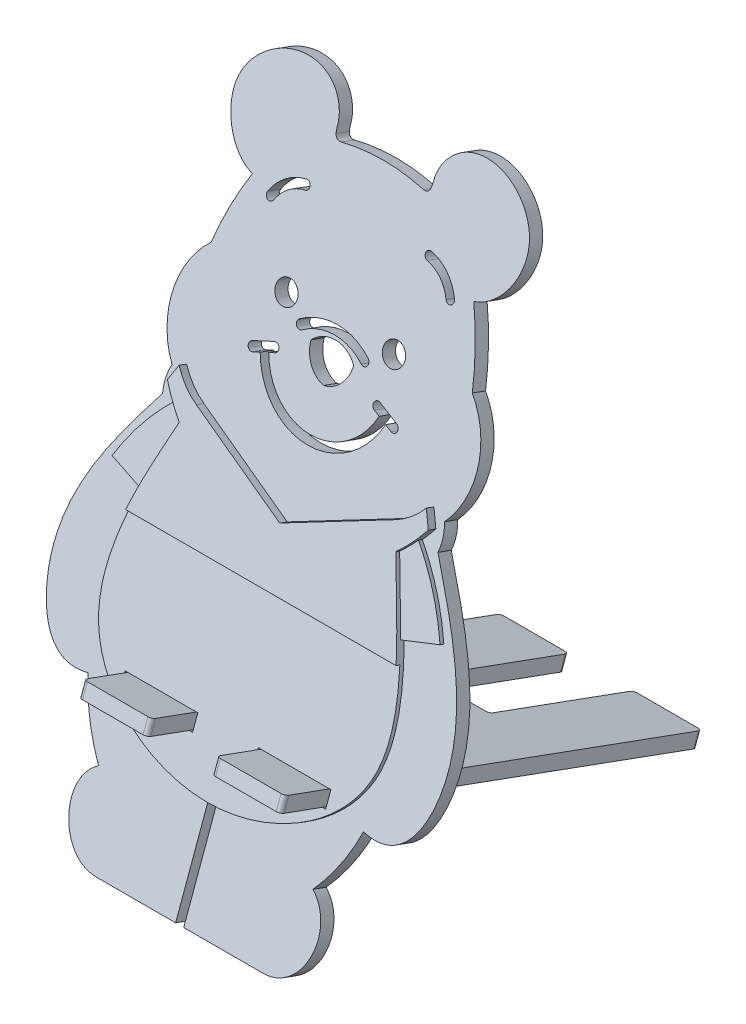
SolidWorks part; units mm, degrees
ref_plane "正面" through (0, 0, 0) normal (0, 0, 1) x (1, 0, 0)
ref_plane "平面" through (0, 0, 0) normal (0, 1, 0) x (1, 0, 0)
ref_plane "右側面" through (0, 0, 0) normal (1, 0, 0) x (0, 0, -1)
sketch "ｽｹｯﾁ1" plane through (0, 0, 0) normal (1, 0, 0) x (0, 0, -1)
  line L0 (0, 0) -> (54.7232, 150.3508)
  line L1 (-3.3662, 37.6222) -> (100, 0)
  line L2 (0, 0) -> (100, 0) construction
  dimension "D1" = 70
  dimension "D2" = 150.3508
  dimension "D3" = 100
  dimension "D4" = 3.3662
  dimension "D5" = 16.0307
  dimension "D6" = 110
  dimension "D7" = 160
ref_plane "キャラクター平面" through (0, 0, 0) normal (0, -0.342, -0.9397) x (0, 0.9397, -0.342)
ref_plane "H部品平面" through (0, 32.1394, -11.6978) normal (0, -0.9397, 0.342) x (0, -0.342, -0.9397)
sketch "ｽｹｯﾁ2" plane through (0, 0, 0) normal (1, 0, 0) x (0, 0, -1)
  line L0 (89.8069, 410.7384) -> (499.1403, 410.7384) construction
sketch "ｽｹｯﾁ3" plane through (0, 0, 0) normal (0, -0.342, -0.9397) x (0, 0.9397, -0.342)
  line L0 (-41.21, 73.4766) -> (72.1423, 80.9757) construction
sketch "ｽｹｯﾁ4" plane through (0, 32.1394, -11.6978) normal (0, -0.9397, 0.342) x (0, -0.342, -0.9397)
  line L0 (-38.6476, 0) -> (93.9693, 0) construction
  line L1 (-16.0307, -25) -> (93.9693, -25)
  line L2 (-16.0307, -25) -> (-16.0307, -8)
  line L3 (-16.0307, 25) -> (93.9693, 25)
  line L4 (93.9693, -25) -> (93.9693, -8)
  line L5 (-16.0307, 8) -> (-16.0307, 25)
  line L6 (0, -8) -> (-16.0307, -8)
  line L7 (0, -8) -> (0, 8)
  line L8 (0, 8) -> (-16.0307, 8)
  line L10 (38.9693, -25) -> (38.9693, 25) construction
  line L11 (55.9693, -8) -> (93.9693, -8)
  line L12 (55.9693, -8) -> (55.9693, 8)
  line L13 (55.9693, 8) -> (93.9693, 8)
  line L15 (93.9693, 8) -> (93.9693, 25)
  point P10 (0, 0)
  dimension "D1" = 50
  dimension "D2" = 16
  dimension "D3" = 38
extrude "ﾎﾞｽ - 押し出し1" add sketch "ｽｹｯﾁ4" against normal blind 3.5
fillet "ﾌｨﾚｯﾄ1" radius 1 12 edges at (-25, 39.2667, 2.7677) (-25, 1.6445, -100.5985) (-8, 1.6445, -100.5985) (-8, 14.6412, -64.8902) (8, 14.6412, -64.8902) (8, 1.6445, -100.5985) (8, 39.2667, 2.7677) (8, 33.7838, -12.2963) (-8, 33.7838, -12.2963) (-8, 39.2667, 2.7677) (25, 1.6445, -100.5985) (25, 39.2667, 2.7677)
sketch "ｽｹｯﾁ5" plane through (0, 0, 0) normal (0, -0.342, -0.9397) x (0, 0.9397, -0.342)
  line L0 (0, 0) -> (160, 0) construction
  line L2 (0, 0) -> (160, 0) construction
  line L3 (0, -20.6588) -> (0, 20.6588)
  line L4 (160, -50) -> (0, -50) construction
  line L5 (160, -50) -> (160, 50) construction
  line L6 (160, 50) -> (0, 50) construction
  line L7 (0, -50) -> (0, 50) construction
  arc A1 (18.8831, 26.5598) -> (33.4347, 34.1329) centre (44.4859, -4.8689) cw
  arc A2 (87.4333, 34.1329) -> (93.1807, 33.7693) centre (89.7206, 24.6806) cw
  arc A3 (93.1807, 33.7693) -> (117.4369, 32.3748) centre (104.5633, 20.1059) cw
  arc A4 (117.4369, 32.3748) -> (132.9214, 27.436) centre (105.733, -31.0641) cw
  arc A5 (146.7886, -10.2351) -> (146.7886, 10.2351) centre (97.8474, 0) ccw
  arc A6 (147.7126, 11.7536) -> (146.7886, 10.2351) centre (148.061, 10.5012) ccw
  arc A7 (147.7126, -11.7536) -> (146.7886, -10.2351) centre (148.061, -10.5012) cw
  arc A8 (117.4369, -32.3748) -> (132.9214, -27.436) centre (105.733, 31.0641) ccw
  arc A9 (93.1807, -33.7693) -> (117.4369, -32.3748) centre (104.5633, -20.1059) ccw
  arc A10 (87.4333, -34.1329) -> (93.1807, -33.7693) centre (89.7206, -24.6806) ccw
  arc A11 (18.8831, -26.5598) -> (33.4347, -34.1329) centre (44.4859, 4.8689) ccw
  spline S0 degree 3 poles (33.4347, 34.1329) (31.2421, 43.568) (55.3222, 55.3631) (75.8244, 41.6379) (87.4333, 34.1329) knots 0 0 0 0 0.341997 1 1 1 1
  spline S1 degree 3 poles (147.7126, 11.7536) (148.409, 11.9474) (151.4916, 11.6741) (157.7965, 15.4413) (159.4018, 27.1993) (147.7488, 40.7457) (134.4962, 33.3634) (132.9214, 27.436) knots 0.065883 0.065883 0.065883 0.065883 0.103766 0.230182 0.409217 0.672978 1 1 1 1
  spline S2 degree 3 poles (147.7126, -11.7536) (148.409, -11.9474) (151.4916, -11.6741) (157.7965, -15.4413) (159.4018, -27.1993) (147.7488, -40.7457) (134.4962, -33.3634) (132.9214, -27.436) knots 0.065883 0.065883 0.065883 0.065883 0.103766 0.230182 0.409217 0.672978 1 1 1 1
  spline S3 degree 3 poles (33.4347, -34.1329) (31.2421, -43.568) (55.3222, -55.3631) (75.8244, -41.6379) (87.4333, -34.1329) knots 0 0 0 0 0.341997 1 1 1 1
  spline S4 degree 3 poles (18.8831, 26.5598) (13.9006, 34.1897) (0, 30.3015) (0, 20.6588) knots 0 0 0 0 1 1 1 1
  spline S5 degree 3 poles (18.8831, -26.5598) (13.9006, -34.1897) (0, -30.3015) (0, -20.6588) knots 0 0 0 0 1 1 1 1
  point P54 (0, 0)
  dimension "D1" = 100
  dimension "D2" = 160
extrude "ﾎﾞｽ - 押し出し2" add sketch "ｽｹｯﾁ5" against normal blind 3.5 separate body
sketch "ｽｹｯﾁ6" plane through (0, 1.1971, 3.2889) normal (0, 0.342, 0.9397) x (1, 0, 0)
  line L0 (0, 0) -> (0, 164.7182) construction
  line L5 (7.5, 37.8) -> (25.5, 37.8)
  line L6 (7.5, 37.8) -> (7.5, 34)
  line L7 (7.5, 34) -> (25.5, 34)
  line L8 (25.5, 37.8) -> (25.5, 34)
  line L9 (-25.5, 37.8) -> (-25.5, 34)
  line L10 (-7.5, 34) -> (-25.5, 34)
  line L11 (-7.5, 37.8) -> (-7.5, 34)
  line L12 (-7.5, 37.8) -> (-25.5, 37.8)
  dimension "D1" = 34
  dimension "D2" = 15
  dimension "D3" = 3.8
  dimension "D4" = 51
extrude "ｶｯﾄ - 押し出し1" cut sketch "ｽｹｯﾁ6" against normal through all
sketch "ｽｹｯﾁ7" plane through (0, 1.1971, 3.2889) normal (0, 0.342, 0.9397) x (1, 0, 0)
  line L0 (-50, 160) -> (50, 160) construction
  line L1 (50, 160) -> (50, 0) construction
  line L2 (-50, 0) -> (50, 0) construction
  line L3 (-50, 160) -> (-50, 0) construction
  line L4 (-50, 160) -> (50, 160)
  line L5 (50, 160) -> (50, 0)
  line L6 (-50, 0) -> (50, 0)
  line L7 (-50, 160) -> (-50, 0)
  line L8 (0, 0) -> (0, 160) construction
  line L10 (-20.6588, 0) -> (20.6588, 0)
  line L11 (-20.6588, 0) -> (20.6588, 0) construction
  line L12 (-25.5, 37.8) -> (-25.5, 34)
  line L13 (-25.5, 34) -> (-7.5, 34)
  line L14 (-7.5, 34) -> (-7.5, 37.8)
  line L15 (-7.5, 37.8) -> (-25.5, 37.8)
  line L16 (-25.5, 37.8) -> (-25.5, 34)
  line L17 (-25.5, 34) -> (-7.5, 34)
  line L18 (-7.5, 34) -> (-7.5, 37.8)
  line L19 (-7.5, 37.8) -> (-25.5, 37.8)
  line L20 (25.5, 37.8) -> (7.5, 37.8)
  line L21 (25.5, 34) -> (25.5, 37.8)
  line L22 (7.5, 34) -> (25.5, 34)
  line L23 (7.5, 37.8) -> (7.5, 34)
  line L24 (25.5, 37.8) -> (7.5, 37.8)
  line L25 (25.5, 34) -> (25.5, 37.8)
  line L26 (7.5, 34) -> (25.5, 34)
  line L27 (7.5, 37.8) -> (7.5, 34)
  arc A11 (26.5598, 18.8831) -> (34.1329, 33.4347) centre (-4.8689, 44.4859) ccw
  arc A12 (34.1329, 87.4333) -> (33.7693, 93.1807) centre (24.6806, 89.7206) ccw
  arc A13 (33.7693, 93.1807) -> (32.3748, 117.4369) centre (20.1059, 104.5633) ccw
  arc A14 (32.3748, 117.4369) -> (27.436, 132.9214) centre (-31.0641, 105.733) ccw
  arc A15 (10.2351, 146.7886) -> (11.7536, 147.7126) centre (10.5012, 148.061) ccw
  arc A16 (10.2351, 146.7886) -> (-10.2351, 146.7886) centre (0, 97.8474) ccw
  arc A17 (-11.7536, 147.7126) -> (-10.2351, 146.7886) centre (-10.5012, 148.061) ccw
  arc A18 (-27.436, 132.9214) -> (-32.3748, 117.4369) centre (31.0641, 105.733) ccw
  arc A19 (-32.3748, 117.4369) -> (-33.7693, 93.1807) centre (-20.1059, 104.5633) ccw
  arc A20 (-33.7693, 93.1807) -> (-34.1329, 87.4333) centre (-24.6806, 89.7206) ccw
  arc A21 (-34.1329, 33.4347) -> (-26.5598, 18.8831) centre (4.8689, 44.4859) ccw
  arc A22 (26.5598, 18.8831) -> (34.1329, 33.4347) centre (-4.8689, 44.4859) ccw construction
  arc A23 (34.1329, 87.4333) -> (33.7693, 93.1807) centre (24.6806, 89.7206) ccw construction
  arc A24 (33.7693, 93.1807) -> (32.3748, 117.4369) centre (20.1059, 104.5633) ccw construction
  arc A25 (32.3748, 117.4369) -> (27.436, 132.9214) centre (-31.0641, 105.733) ccw construction
  arc A26 (10.2351, 146.7886) -> (11.7536, 147.7126) centre (10.5012, 148.061) ccw construction
  arc A27 (10.2351, 146.7886) -> (-10.2351, 146.7886) centre (0, 97.8474) ccw construction
  arc A28 (-11.7536, 147.7126) -> (-10.2351, 146.7886) centre (-10.5012, 148.061) ccw construction
  arc A29 (-27.436, 132.9214) -> (-32.3748, 117.4369) centre (31.0641, 105.733) ccw construction
  arc A30 (-32.3748, 117.4369) -> (-33.7693, 93.1807) centre (-20.1059, 104.5633) ccw construction
  arc A31 (-33.7693, 93.1807) -> (-34.1329, 87.4333) centre (-24.6806, 89.7206) ccw construction
  arc A32 (-34.1329, 33.4347) -> (-26.5598, 18.8831) centre (4.8689, 44.4859) ccw construction
  spline S6 degree 3 poles (72.4944, 2991.1289) (-501.5073, -3030.2136) (1006.3518, 2934.0548) (-1345.6059, -2639.4958) knots -4.537924 -4.537924 -4.537924 -4.537924 5.563974 5.563974 5.563974 5.563974 only from (20.6588, 0) to (26.5598, 18.8831)
  spline S7 degree 3 poles (-1019.39, 2838.2802) (-91.6409, -72.2852) (324.7031, 141.9278) (-491.2986, 183.3672) (3031.4585, 8.9188) knots -1.885518 -1.885518 -1.885518 -1.885518 0.341997 5.063495 5.063495 5.063495 5.063495 only from (34.1329, 33.4347) to (34.1329, 87.4333)
  spline S8 degree 3 poles (754.3512, 3034.7906) (-267.8393, -23.8432) (79.4368, 114.4657) (27.1993, 159.4018) (15.4413, 157.7965) (3.5956, 137.971) (56.0874, 119.4691) (-2985.9867, 253.8259) knots -2.132854 -2.132854 -2.132854 -2.132854 0.392904 0.656666 0.835701 0.962117 1.73626 1.73626 1.73626 1.73626 only from (27.436, 132.9214) to (11.7536, 147.7126)
  spline S9 degree 3 poles (2985.9581, 253.8247) (-56.0871, 119.4692) (-3.5956, 137.971) (-15.4413, 157.7965) (-27.1993, 159.4018) (-79.4369, 114.4656) (267.8406, -23.8438) (-754.3577, 3034.8102) knots -0.670375 -0.670375 -0.670375 -0.670375 0.103766 0.230182 0.409217 0.672978 3.198743 3.198743 3.198743 3.198743 only from (-11.7536, 147.7126) to (-27.436, 132.9214)
  spline S10 degree 3 poles (-3031.4802, 8.9177) (491.3009, 183.3673) (-324.7037, 141.9281) (91.641, -72.2852) (1019.3903, 2838.2812) knots -4.063505 -4.063505 -4.063505 -4.063505 0.658003 2.885518 2.885518 2.885518 2.885518 only from (-34.1329, 87.4333) to (-34.1329, 33.4347)
  spline S11 degree 3 poles (1345.6242, -2639.5392) (-1006.3607, 2934.0882) (501.5102, -3030.2346) (-72.4952, 2991.1371) knots -4.564001 -4.564001 -4.564001 -4.564001 5.537928 5.537928 5.537928 5.537928 only from (-26.5598, 18.8831) to (-20.6588, 0)
  spline S12 degree 3 poles (20.6588, 0) (30.3015, 0) (34.1897, 13.9006) (26.5598, 18.8831) knots 0 0 0 0 1 1 1 1 construction
  spline S13 degree 3 poles (34.1329, 33.4347) (43.568, 31.2421) (55.3631, 55.3222) (41.6379, 75.8244) (34.1329, 87.4333) knots 0 0 0 0 0.341997 1 1 1 1 construction
  spline S14 degree 3 poles (27.436, 132.9214) (33.3634, 134.4962) (40.7457, 147.7488) (27.1993, 159.4018) (15.4413, 157.7965) (11.6741, 151.4916) (11.9474, 148.409) (11.7536, 147.7126) knots 0.065883 0.065883 0.065883 0.065883 0.392904 0.656666 0.835701 0.962117 1 1 1 1 construction
  spline S15 degree 3 poles (-11.7536, 147.7126) (-11.9474, 148.409) (-11.6741, 151.4916) (-15.4413, 157.7965) (-27.1993, 159.4018) (-40.7457, 147.7488) (-33.3634, 134.4962) (-27.436, 132.9214) knots 0.065883 0.065883 0.065883 0.065883 0.103766 0.230182 0.409217 0.672978 1 1 1 1 construction
  spline S16 degree 3 poles (-34.1329, 87.4333) (-41.6379, 75.8244) (-55.3631, 55.3222) (-43.568, 31.2421) (-34.1329, 33.4347) knots 0 0 0 0 0.658003 1 1 1 1 construction
  spline S17 degree 3 poles (-26.5598, 18.8831) (-34.1897, 13.9006) (-30.3015, 0) (-20.6588, 0) knots 0 0 0 0 1 1 1 1 construction
  dimension "D3" = 100
  dimension "D4" = 160
  dimension "D5" = 34
  dimension "D6" = 18
  dimension "D7" = 15
  dimension "D8" = 3.8
  dimension "D9" = 18
  dimension "D10" = 24.5
  dimension "D11" = 24.5
  dimension "D1" = 0
  dimension "D2" = 0
  dimension "D12" = 0
sketch "ｽｹｯﾁ8" plane through (0, 1.1971, 3.2889) normal (0, 0.342, 0.9397) x (1, 0, 0)
  line L0 (0, 0) -> (0, 196.5219) construction
  line L1 (15.5404, 103.767) -> (17.1662, 103.0968)
  line L2 (13.0837, 106.9429) -> (17.9284, 104.9458)
  line L3 (12.3215, 105.0938) -> (13.6887, 104.5303)
  line L4 (-13.0837, 106.9429) -> (-17.9284, 104.9458)
  line L5 (-12.3215, 105.0938) -> (-13.6887, 104.5303)
  line L6 (-15.5404, 103.767) -> (-17.1662, 103.0968)
  arc A0 (15.2931, 136.2527) -> (22.2741, 131.0046) centre (13.6188, 126.7584) cw construction
  arc A1 (23.1718, 131.445) -> (15.4667, 137.2375) centre (13.6188, 126.7584) ccw
  arc A2 (21.3763, 130.5641) -> (15.1194, 135.2679) centre (13.6188, 126.7584) ccw
  arc A3 (21.3763, 130.5641) -> (23.1718, 131.445) centre (22.2741, 131.0046) ccw
  arc A4 (15.4667, 137.2375) -> (15.1194, 135.2679) centre (15.2931, 136.2527) ccw
  circle A5 centre (13.326, 116.3517) radius 2.7332
  arc A6 (-8.4251, 112.3497) -> (7.4387, 112.3497) centre (-0.4932, 101.0861) cw construction
  arc A7 (8.0145, 113.1673) -> (-9.0008, 113.1673) centre (-0.4932, 101.0861) ccw
  arc A8 (6.8629, 111.5321) -> (-7.8493, 111.5321) centre (-0.4932, 101.0861) ccw
  arc A9 (6.8629, 111.5321) -> (8.0145, 113.1673) centre (7.4387, 112.3497) ccw
  arc A10 (-9.0008, 113.1673) -> (-7.8493, 111.5321) centre (-8.4251, 112.3497) ccw
  arc A11 (-14.8679, 104.9374) -> (14.6146, 104.1486) centre (0, 109.2768) ccw construction
  arc A12 (-15.5404, 103.767) -> (15.5404, 103.767) centre (0, 109.2768) ccw
  arc A13 (-13.6887, 104.5303) -> (13.6887, 104.5303) centre (0, 109.2768) ccw
  arc A16 (13.0837, 106.9429) -> (12.3215, 105.0938) centre (12.7026, 106.0183) ccw
  arc A17 (17.1662, 103.0968) -> (17.9284, 104.9458) centre (17.5473, 104.0213) ccw
  arc A18 (-5.3294, 110.7542) -> (5.3276, 110.5959) centre (-0.0695, 106.0524) cw
  arc A19 (5.3276, 110.5959) -> (0, 104.3287) centre (-1.2006, 110.7474) cw
  arc A20 (0, 104.3287) -> (-5.3294, 110.7542) centre (1.2006, 110.7474) cw
  arc A21 (-17.1662, 103.0968) -> (-17.9284, 104.9458) centre (-17.5473, 104.0213) cw
  arc A22 (-13.0837, 106.9429) -> (-12.3215, 105.0938) centre (-12.7026, 106.0183) cw
  circle A23 centre (-13.326, 116.3517) radius 2.7332
  arc A24 (-15.2931, 136.2527) -> (-22.2741, 131.0046) centre (-13.6188, 126.7584) ccw construction
  arc A25 (-23.1718, 131.445) -> (-15.4667, 137.2375) centre (-13.6188, 126.7584) cw
  arc A26 (-21.3763, 130.5641) -> (-15.1194, 135.2679) centre (-13.6188, 126.7584) cw
  arc A27 (-21.3763, 130.5641) -> (-23.1718, 131.445) centre (-22.2741, 131.0046) cw
  arc A28 (-15.4667, 137.2375) -> (-15.1194, 135.2679) centre (-15.2931, 136.2527) cw
  point P6 (19.4119, 134.4645)
  point P16 (-0.4932, 114.8623)
  point P21 (0, 93.7885)
  point P52 (-19.4119, 134.4645)
  dimension "D2" = 1
  dimension "D3" = 1
  dimension "D4" = 1
extrude "ｶｯﾄ - 押し出し3" cut sketch "ｽｹｯﾁ8" against normal through all
sketch "ｽｹｯﾁ9" plane through (0, 1.1971, 3.2889) normal (0, 0.342, 0.9397) x (1, 0, 0)
  line L0 (0, 0) -> (0, 34.202) construction
  line L1 (0, 77.9605) -> (24.6806, 89.7206)
  line L2 (0, 0) -> (0, 160) construction
  line L3 (30.6558, 94.6663) -> (32.334, 91.1442)
  line L4 (0, 0) -> (0, 177.9301) construction
  line L5 (-30.6558, 94.6663) -> (-32.334, 91.1442)
  line L6 (0, 77.9605) -> (-24.6806, 89.7206)
  line L12 (7.5, 37.8) -> (7.5, 34)
  line L13 (25.5, 37.8) -> (7.5, 37.8)
  line L14 (25.5, 34) -> (25.5, 37.8)
  line L15 (7.5, 34) -> (25.5, 34)
  line L16 (7.5, 37.8) -> (7.5, 34)
  line L17 (25.5, 37.8) -> (7.5, 37.8)
  line L18 (25.5, 34) -> (25.5, 37.8)
  line L19 (7.5, 34) -> (25.5, 34)
  line L21 (-7.5, 37.8) -> (-25.5, 37.8)
  line L22 (-7.5, 34) -> (-7.5, 37.8)
  line L23 (-25.5, 34) -> (-7.5, 34)
  line L24 (-25.5, 37.8) -> (-25.5, 34)
  line L25 (-7.5, 37.8) -> (-25.5, 37.8)
  line L26 (-7.5, 34) -> (-7.5, 37.8)
  line L27 (-25.5, 34) -> (-7.5, 34)
  line L28 (-25.5, 37.8) -> (-25.5, 34)
  arc A0 (24.6806, 89.7206) -> (30.6558, 94.6663) centre (17.8507, 104.0543) ccw
  arc A1 (32.334, 91.1442) -> (26.6087, 84.4031) centre (0.1444, 112.6818) cw
  arc A2 (-32.334, 91.1442) -> (-27.3418, 85.1074) centre (-0.1444, 112.6818) ccw
  arc A3 (-24.6806, 89.7206) -> (-30.6558, 94.6663) centre (-17.8507, 104.0543) cw
  spline S0 degree 3 poles (26.6087, 84.4031) (30.3532, 73.237) (45.8056, 40.9888) (0.2642, 15.5873) (-45.5359, 40.0808) (-31.5524, 73.4471) (-27.2895, 85.2519) knots 0 0 0 0 0.251794 0.496348 0.735171 1 1 1 1
  dimension "D1" = 0
  dimension "D2" = 0
extrude "ﾎﾞｽ - 押し出し3" add sketch "ｽｹｯﾁ9" along normal blind 2
sketch "ｽｹｯﾁ10" plane through (0, 1.8811, 5.1683) normal (0, 0.342, 0.9397) x (1, 0, 0)
  line L3 (-41.2517, 65.3335) -> (56.5614, 65.3335)
  line L4 (-41.2517, 65.3335) -> (-41.2517, 17.1312)
  line L5 (-41.2517, 17.1312) -> (56.5614, 17.1312)
  line L6 (56.5614, 65.3335) -> (56.5614, 17.1312)
extrude "ｶｯﾄ - 押し出し4" cut sketch "ｽｹｯﾁ10" against normal blind 1
sketch "ｽｹｯﾁ11" plane through (0, 1.1971, 3.2889) normal (0, 0.342, 0.9397) x (1, 0, 0)
  line L0 (30.6062, 69.1785) -> (40.6565, 72.6089)
  line L1 (0, 0) -> (0, 103.375) construction
  line L3 (-30.6062, 69.1785) -> (-40.6565, 72.6089)
  line L5 (-30.6062, 69.1785) -> (30.6062, 69.1785)
  line L6 (0, 77.9605) -> (24.6806, 89.7206) construction
  line L7 (0, 77.9605) -> (-24.6806, 89.7206) construction
  line L8 (0, 77.9605) -> (24.6806, 89.7206)
  line L9 (0, 77.9605) -> (-24.6806, 89.7206)
  arc A0 (40.6565, 72.6089) -> (26.8354, 90.9632) centre (-5.5112, 52.2249) ccw
  arc A1 (-40.6565, 72.6089) -> (-26.8354, 90.9632) centre (5.5112, 52.2249) cw
  arc A2 (24.6806, 89.7206) -> (30.6558, 94.6663) centre (17.8507, 104.0543) ccw construction
  arc A3 (-30.6558, 94.6663) -> (-24.6806, 89.7206) centre (-17.8507, 104.0543) ccw construction
  arc A4 (24.6806, 89.7206) -> (26.8354, 90.9632) centre (17.8507, 104.0543) ccw
  arc A5 (-26.8354, 90.9632) -> (-24.6806, 89.7206) centre (-17.8507, 104.0543) ccw
extrude "ﾎﾞｽ - 押し出し5" add sketch "ｽｹｯﾁ11" along normal blind 1
sketch "ｽｹｯﾁ12" plane through (0, 1.1971, 3.2889) normal (0, 0.342, 0.9397) x (1, 0, 0)
  line L0 (0, 0) -> (0, 39.1479) construction
  line L2 (-1, 23.7185) -> (-1, -2.5614)
  line L3 (-1, -2.5614) -> (1, -2.5614)
  line L4 (1, 23.735) -> (1, -2.5614)
  spline S0 degree 3 poles (2606.6956, -1475.2624) (-378.4445, 351.471) (127.5597, 86.5887) (0.2642, 15.5873) (-130.6186, 85.5824) (386.9325, 386.1575) (-2453.5517, -1707.6854) knots -1.319749 -1.319749 -1.319749 -1.319749 0.251794 0.496348 0.735171 2.389938 2.389938 2.389938 2.389938 only from (33.1771, 65.3335) to (-33.877, 65.3335) construction
  spline S1 degree 3 poles (1, 23.735) (0.6667, 23.7242) (-0.0001, 23.7105) (-0.6668, 23.7132) (-1, 23.7185) knots 0.490934 0.490934 0.490934 0.490934 0.496348 0.501762 0.501762 0.501762 0.501762
  dimension "D1" = 2
extrude "ｶｯﾄ - 押し出し5" cut sketch "ｽｹｯﾁ12" against normal through all
